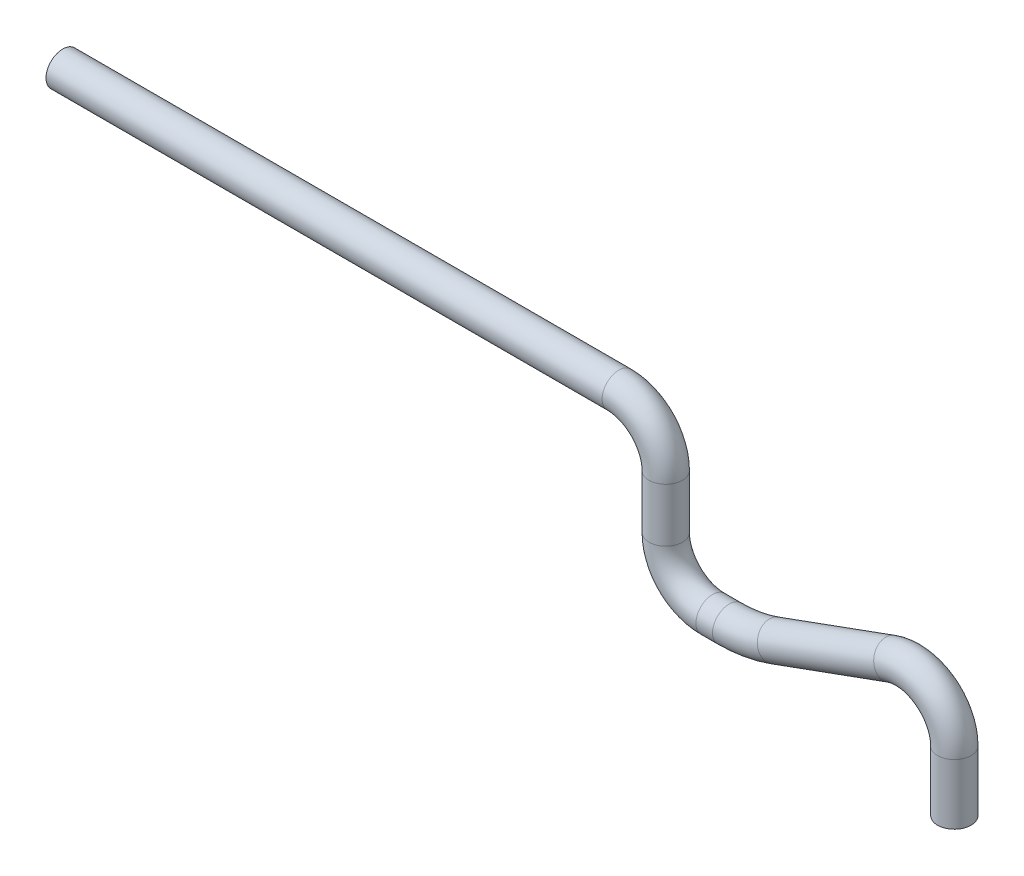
SolidWorks part; units mm, degrees
ref_plane "Face" through (0, 0, 0) normal (0, 0, 1) x (1, 0, 0)
ref_plane "Dessus" through (0, 0, 0) normal (0, 1, 0) x (1, 0, 0)
ref_plane "Droite" through (0, 0, 0) normal (1, 0, 0) x (0, 0, -1)
sketch "Esquisse1" plane through (0, 0, 0) normal (0, 0, 1) x (1, 0, 0)
  line L0 (-35, 0) -> (-7, 0)
  line L1 (0, -7) -> (0, -15)
  line L2 (7, -22) -> (9.4735, -22)
  line L3 (16.3139, -20.7939) -> (33.676, -14.4745)
  line L4 (43.0702, -21.0524) -> (43.0702, -30.0554)
  arc A0 (33.676, -14.4745) -> (43.0702, -21.0524) centre (36.0702, -21.0524) cw
  arc A1 (16.3139, -20.7939) -> (9.4735, -22) centre (9.4735, -2) cw
  arc A2 (0, -15) -> (7, -22) centre (7, -15) ccw
  arc A3 (-7, 0) -> (0, -7) centre (-7, -7) cw
  point P9 (43.0702, -11.0554)
  point P12 (13, -22)
  point P15 (0, -22)
  point P18 (0, 0)
  dimension "D6" = 7
  dimension "D8" = 20
  dimension "D9" = 7
  dimension "D1" = 35
  dimension "D2" = 22
  dimension "D3" = 13
  dimension "D4" = 32
  dimension "D5" = 19
  dimension "D7" = 200
ref_plane "Plan1" through (-35, 0, 0) normal (1, 0, 0) x (0, 0, -1)
sketch "Esquisse2" plane through (-35, 0, 0) normal (1, 0, 0) x (0, 0, -1)
  circle A0 centre (0, 0) radius 2.5
  dimension "D1" = 5
sweep "Base-Balayage" add profiles "Esquisse2" path "Esquisse1"
sketch "Esquisse4" plane through (0, 0, 0) normal (0, 1, 0) x (1, 0, 0)
  line L0 (-35, 0) -> (-90, 0)
  line L1 (-35, -6.1531) -> (-35, 6.1531) construction
  line L2 (-7, 0) -> (-35, 0) construction
  dimension "D1" = 55
  dimension "D2" = 180
sketch "Esquisse5" plane through (-35, 0, 0) normal (-1, 0, 0) x (0, 0, 1)
  circle A1 centre (0, 0) radius 2.5
  circle A2 centre (0, 0) radius 2.5
  dimension "D1" = 0
sweep "Boss.-Balayage1" add profiles "Esquisse5" path "Esquisse4"
sketch "Esquisse6" plane through (0, 0, 0) normal (0, 1, 0) x (1, 0, 0)
  line L0 (-90, -33.9879) -> (-94.2834, -13.8362)
  line L1 (-90, 2.5) -> (-90, -2.5) construction
  line L2 (-94.2834, -13.8362) -> (-82.0756, -13.8362)
  line L3 (-90, -33.9879) -> (-82.0756, -13.8362)
  dimension "D1" = 12
